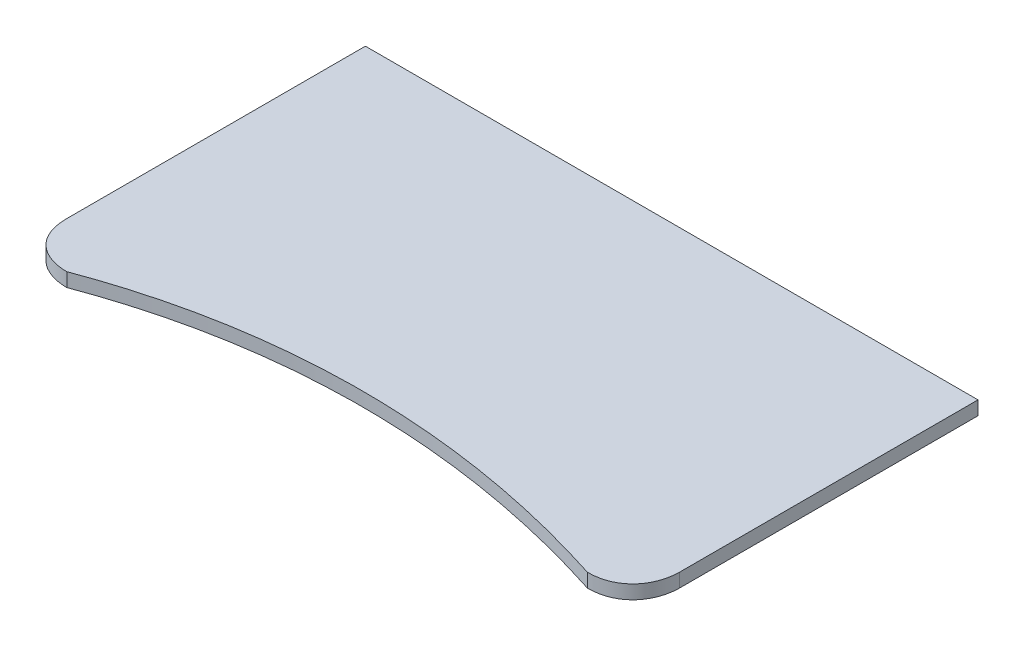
SolidWorks part; units mm, degrees
ref_plane "Front Plane" through (0, 0, 0) normal (0, 0, 1) x (1, 0, 0)
ref_plane "Top Plane" through (0, 0, 0) normal (0, 1, 0) x (1, 0, 0)
ref_plane "Right Plane" through (0, 0, 0) normal (1, 0, 0) x (0, 0, -1)
sketch "Sketch1" plane through (0, 0, 0) normal (0, 1, 0) x (1, 0, 0)
  line L1 (-400, -225) -> (400, -225)
  line L2 (-400, -225) -> (-400, 225)
  line L3 (-400, 225) -> (400, 225)
  line L4 (400, -225) -> (400, 225)
  line L5 (-400, -225) -> (400, 225) construction
  line L6 (-400, 225) -> (400, -225) construction
  point P0 (0, 0)
  dimension "D1" = 800
  dimension "D2" = 450
extrude "Boss-Extrude1" add sketch "Sketch1" along normal blind 18
sketch "Sketch2" plane through (0, 0, 0) normal (0, 1, 0) x (1, 0, 0)
  line L0 (400, 225) -> (-400, 225) construction
  line L1 (-350, 160) -> (-332, 160)
  line L2 (-350, 160) -> (-350, 110)
  line L3 (-350, 110) -> (-332, 110)
  line L4 (-332, 160) -> (-332, 110)
  line L5 (-350, 50) -> (-332, 50)
  line L6 (-350, 50) -> (-350, 0)
  line L7 (-350, 0) -> (-332, 0)
  line L8 (-332, 50) -> (-332, 0)
  line L9 (-350, -60) -> (-332, -60)
  line L10 (-350, -60) -> (-350, -110)
  line L11 (-350, -110) -> (-332, -110)
  line L12 (-332, -60) -> (-332, -110)
  line L13 (-400, 225) -> (-400, -225) construction
  line L16 (350, -110) -> (332, -110)
  line L17 (332, -60) -> (332, -110)
  line L18 (350, -60) -> (350, -110)
  line L19 (350, -60) -> (332, -60)
  line L20 (350, 0) -> (332, 0)
  line L21 (332, 50) -> (332, 0)
  line L22 (350, 50) -> (350, 0)
  line L23 (350, 50) -> (332, 50)
  line L24 (350, 110) -> (332, 110)
  line L25 (350, 160) -> (350, 110)
  line L26 (332, 160) -> (332, 110)
  line L27 (350, 160) -> (332, 160)
  dimension "D1" = 65
  dimension "D2" = 60
  dimension "D3" = 60
  dimension "D4" = 18
  dimension "D5" = 50
  dimension "D6" = 50
extrude "Cut-Extrude1" cut sketch "Sketch2" along normal blind 13
sketch "Sketch6" plane through (0, 0, 0) normal (0, -1, 0) x (-1, 0, 0)
  line L0 (-400, -225) -> (-400, 225) construction
  line L1 (400, -225) -> (-400, -225) construction
  line L2 (400, 225) -> (400, -225) construction
  line L3 (316.9607, -225) -> (363.0406, -225) construction
  line L4 (400, -199.1201) -> (400, -130.4085) construction
  line L5 (-400, -195.9184) -> (-400, -128.9491) construction
  line L6 (-308, -225) -> (-374.8623, -225) construction
  line L7 (-400, -165) -> (-400, -225)
  line L8 (-340, -225) -> (340, -225)
  line L9 (340, -225) -> (400, -225)
  spline S0 degree 3 poles (400, -165) (400, -207.9448) (368.8, -225) (340, -225) knots 0 0 0 0 1 1 1 1
  spline S1 degree 3 poles (-400, -165) (-400, -192.9039) (-381.7889, -225) (-340, -225) knots 0 0 0 0 1 1 1 1
  spline S2 degree 3 poles (-340, -225) (-89.5991, -144.6483) (139.7823, -150.2349) (340, -225) knots 0 0 0 0 1 1 1 1
  point P0 (-400, -165)
  point P1 (-340, -225)
  point P4 (340, -225)
  point P7 (400, -165)
  dimension "D1" = 60
  dimension "D2" = 60
  dimension "D3" = 60
  dimension "D4" = 60
extrude "Cut-Extrude2" cut sketch "Sketch6" against normal blind 18 contours S2 M2 | S1 M1 M2 | S0 M3 M2
